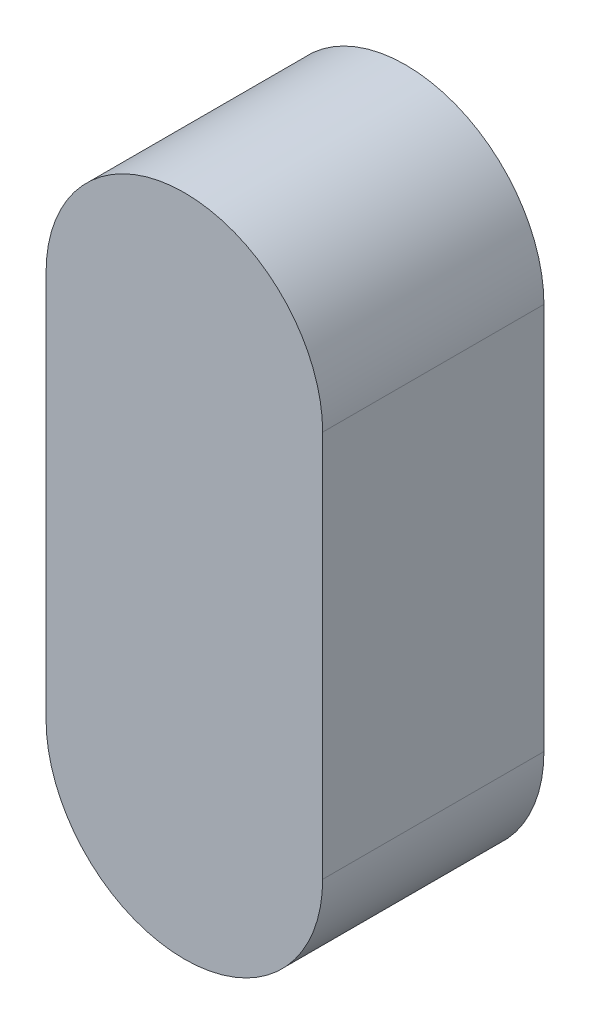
SolidWorks part; units mm, degrees
ref_plane "前视基准面" through (0, 0, 0) normal (0, 0, 1) x (1, 0, 0)
ref_plane "上视基准面" through (0, 0, 0) normal (0, 1, 0) x (1, 0, 0)
ref_plane "右视基准面" through (0, 0, 0) normal (1, 0, 0) x (0, 0, -1)
sketch "草图1" plane through (0, 0, 0) normal (0, 0, 1) x (1, 0, 0)
  line L2 (7, -93.5) -> (7, -86.5)
  line L3 (2, -86.5) -> (2, -93.5)
  arc A2 (7, -86.5) -> (2, -86.5) centre (4.5, -86.5) ccw
  arc A3 (2, -93.5) -> (7, -93.5) centre (4.5, -93.5) ccw
  arc A5 (7, -86.5) -> (2, -86.5) centre (4.5, -86.5) ccw construction
  dimension "D1" = 93.5
extrude "拉伸1" add sketch "草图1" along normal blind 4
